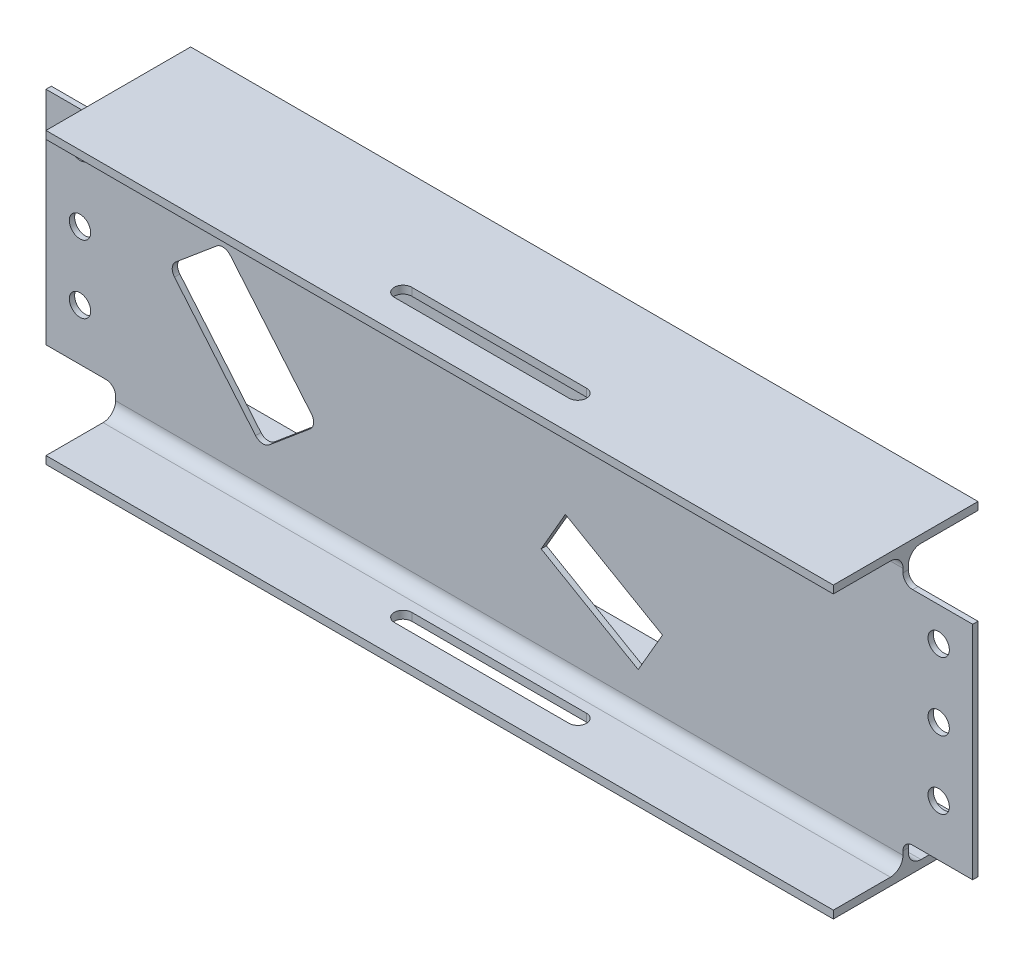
SolidWorks part; units mm, degrees
ref_plane "Front Plane" through (0, 0, 0) normal (0, 0, 1) x (1, 0, 0)
ref_plane "Top Plane" through (0, 0, 0) normal (0, 1, 0) x (1, 0, 0)
ref_plane "Right Plane" through (0, 0, 0) normal (1, 0, 0) x (0, 0, -1)
sketch "Member Sketch" plane through (0, 0, 0) normal (0, 1, 0) x (1, 0, 0)
  line L0 (0, 0) -> (1000, 0)
  line L2 (0, 0) -> (1000, 0) construction
other "Structural Member1"
ref_plane "Plane1" through (0, 0, 0) normal (1, 0, 0) x (0, 0, -1)
sketch "Sketch11" plane through (0, -149, 0) normal (1, 0, 0) x (0, 0, -1)
  line L0 (-74.5, 149) -> (74.5, 149)
  line L1 (74.5, 149) -> (74.5, 141)
  line L2 (74.5, 141) -> (15.75, 141)
  line L3 (2.75, 128) -> (2.75, -128)
  line L4 (-2.75, 0) -> (2.75, 0) construction
  line L5 (0, -149) -> (0, 149) construction
  line L6 (-2.75, 128) -> (-2.75, -128)
  line L7 (-74.5, 141) -> (-15.75, 141)
  line L8 (-74.5, 149) -> (-74.5, 141)
  line L9 (-74.5, -149) -> (-74.5, -141)
  line L10 (-74.5, -141) -> (-15.75, -141)
  line L11 (74.5, -141) -> (15.75, -141)
  line L12 (74.5, -149) -> (74.5, -141)
  line L13 (-74.5, -149) -> (74.5, -149)
  line L14 (-74.5, 141) -> (-74.5, -141) construction
  line L15 (74.5, 141) -> (74.5, -141) construction
  line L16 (-2.75, 0) -> (-74.5, 0) construction
  line L17 (2.75, 0) -> (74.5, 0) construction
  arc A0 (15.75, 141) -> (2.75, 128) centre (15.75, 128) ccw
  arc A3 (-15.75, 141) -> (-2.75, 128) centre (-15.75, 128) cw
  arc A4 (-15.75, -141) -> (-2.75, -128) centre (-15.75, -128) ccw
  arc A7 (15.75, -141) -> (2.75, -128) centre (15.75, -128) cw
  point P18 (0, 0)
  dimension "Root Radius(r)" = 13
  dimension "Section Depth(D)" = 298
  dimension "Flange Width(B)" = 149
  dimension "Web Thickness(t)" = 5.5
  dimension "Flange Thickness(T)" = 8
sketch "Sketch2" plane through (0, 0, 0) normal (0, 1, 0) x (1, 0, 0)
  line L0 (500, 0) -> (1500, 0) construction
  line L1 (0, -81.95) -> (0, 81.95) construction
  line L2 (-163.9, 0) -> (163.9, 0) construction
  text T0 "310 UB 32.0" font "Century Gothic" height 30
  dimension "D1" = 500
  dimension "D2" = 1000
extrude "MARKING" [suppressed] cut sketch "Sketch2" against normal blind 1
other "0008-AABE004-CN02-FP01D01-1 - MEMBER2 CAVITY"
other "0008-AABE004<1>@0008-AA/0008-AABE004-CN02-FP01<1>@0008-AABE004/0008-AABE004-CN02-FP01D01<1>@0008-AABE004-CN02-FP011"
other "0008-AABE004-CN02-FP01D02-1 - MEMBER2 CAVITY"
other "0008-AABE004<1>@0008-AA/0008-AABE004-CN02-FP01<1>@0008-AABE004/0008-AABE004-CN02-FP01D02<1>@0008-AABE004-CN02-FP011"
other "0008-AABE002-CN01-FP02D01-1 - MEMBER2 CAVITY"
other "0008-AABE002<1>@0008-AA/0008-AABE002-CN01-FP02<1>@0008-AABE002/0008-AABE002-CN01-FP02D01<1>@0008-AABE002-CN01-FP021"
other "0008-AABE002-CN01-FP02D02-1 - MEMBER2 CAVITY"
other "0008-AABE002<1>@0008-AA/0008-AABE002-CN01-FP02<1>@0008-AABE002/0008-AABE002-CN01-FP02D02<1>@0008-AABE002-CN01-FP021"
sketch "Sketch12" plane through (0, 0, -2.75) normal (0, 0, -1) x (-1, 0, 0)
  line L0 (-657.75, -204.4338) -> (-557.75, -146.6987)
  line L1 (-657.75, -204.4338) -> (-632.75, -247.735)
  line L2 (-557.75, -146.6987) -> (-532.75, -190)
  line L3 (-632.75, -247.735) -> (-532.75, -190)
  line L4 (-22.75, -263) -> (-22.75, -35) construction
  line L5 (-905.5, -298) -> (-94.5, -298) construction
  line L6 (-905.5, 0) -> (-94.5, 0) construction
  line L7 (-296.1053, -187.8046) -> (-212.5429, -88.2188)
  line L8 (-294.8727, -201.8929) -> (-252.7403, -237.2462)
  line L9 (-198.4546, -86.9862) -> (-156.3221, -122.3396)
  line L10 (-238.6519, -236.0137) -> (-155.0896, -136.4279)
  arc A0 (-238.6519, -236.0137) -> (-252.7403, -237.2462) centre (-246.3124, -229.5858) cw
  arc A1 (-294.8727, -201.8929) -> (-296.1053, -187.8046) centre (-288.4448, -194.2325) cw
  arc A2 (-198.4546, -86.9862) -> (-212.5429, -88.2188) centre (-204.8824, -94.6467) ccw
  arc A3 (-156.3221, -122.3396) -> (-155.0896, -136.4279) centre (-162.75, -130) cw
  dimension "D6" = 10
  dimension "D1" = 510
  dimension "D2" = 100
  dimension "D3" = 30
  dimension "D4" = 50
  dimension "D5" = 190
  dimension "D7" = 140
  dimension "D8" = 50
  dimension "D9" = 130
  dimension "D10" = 75
  dimension "D11" = 150
extrude "Cut-Extrude1" cut sketch "Sketch12" against normal through all
sketch "Sketch13" plane through (0, 0, 0) normal (0, 1, 0) x (1, 0, 0)
  line L0 (422.75, -35) -> (602.75, -35) construction
  line L1 (422.75, -26) -> (602.75, -26)
  line L2 (422.75, -44) -> (602.75, -44)
  line L3 (-163.9, 0) -> (163.9, 0) construction
  arc A0 (422.75, -26) -> (422.75, -44) centre (422.75, -35) ccw
  arc A1 (602.75, -44) -> (602.75, -26) centre (602.75, -35) ccw
  point P2 (512.75, -35)
  dimension "D1" = 18
  dimension "D2" = 180
  dimension "D3" = 400
  dimension "D4" = 35
extrude "Cut-Extrude2" cut sketch "Sketch13" against normal through all
